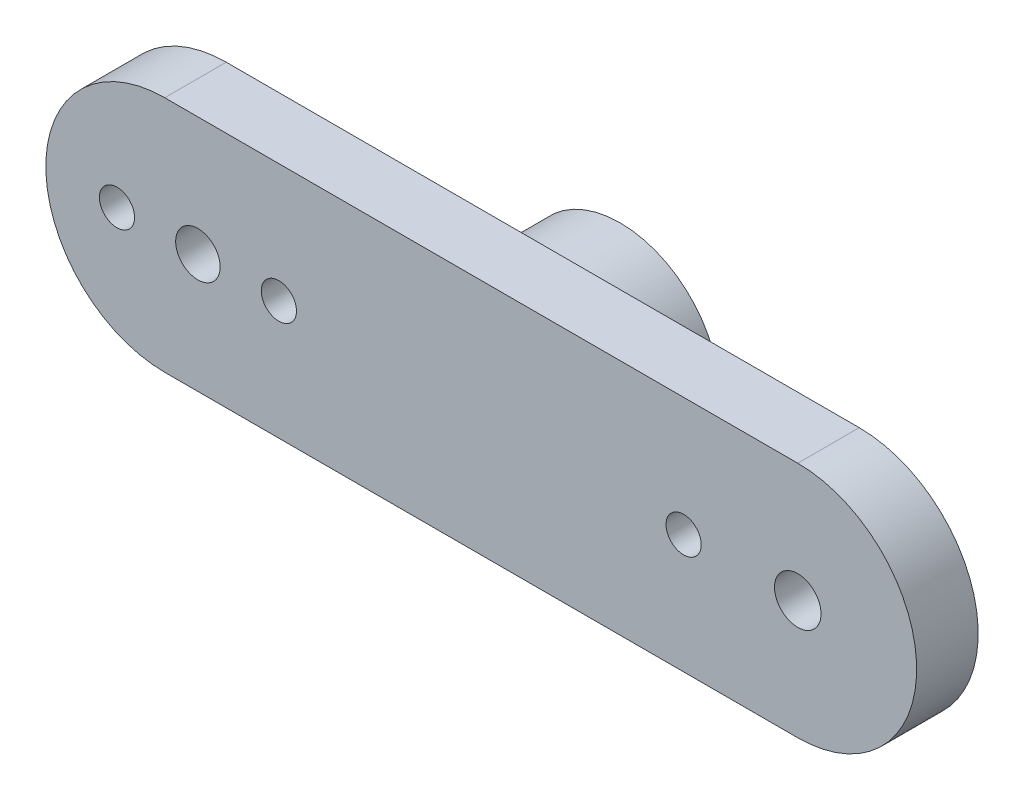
SolidWorks part; units mm, degrees
ref_plane "Front Plane" through (0, 0, 0) normal (0, 0, 1) x (1, 0, 0)
ref_plane "Top Plane" through (0, 0, 0) normal (0, 1, 0) x (1, 0, 0)
ref_plane "Right Plane" through (0, 0, 0) normal (1, 0, 0) x (0, 0, -1)
sketch "Sketch1" plane through (0, 0, 0) normal (0, 0, 1) x (1, 0, 0)
  circle A0 centre (14.9422, 11.0284) radius 2.96
  circle A1 centre (14.9422, 11.0284) radius 4.915
extrude "Boss-Extrude1" add sketch "Sketch1" along normal up to surface (3.82 mm away)
sketch "Sketch2" plane through (0, 0, 3.82) normal (0, 0, 1) x (1, 0, 0)
  line L1 (30.5822, 5.1534) -> (-0.6978, 5.1534)
  line L3 (30.5822, 16.9034) -> (-0.6978, 16.9034)
  arc A0 (-0.6978, 16.9034) -> (-0.6978, 5.1534) centre (-0.6978, 11.0284) ccw
  arc A1 (30.5822, 16.9034) -> (30.5822, 5.1534) centre (30.5822, 11.0284) cw
  circle A2 centre (4.9422, 11.0284) radius 0.87
  circle A3 centre (0.9422, 11.0284) radius 1.1
  circle A4 centre (-3.0578, 11.0284) radius 0.87
  circle A5 centre (24.9422, 11.0284) radius 0.87
  circle A6 centre (30.5822, 11.0284) radius 1.15
  point P7 (14.9422, 16.9034)
extrude "Boss-Extrude2" add sketch "Sketch2" along normal blind 3.04
